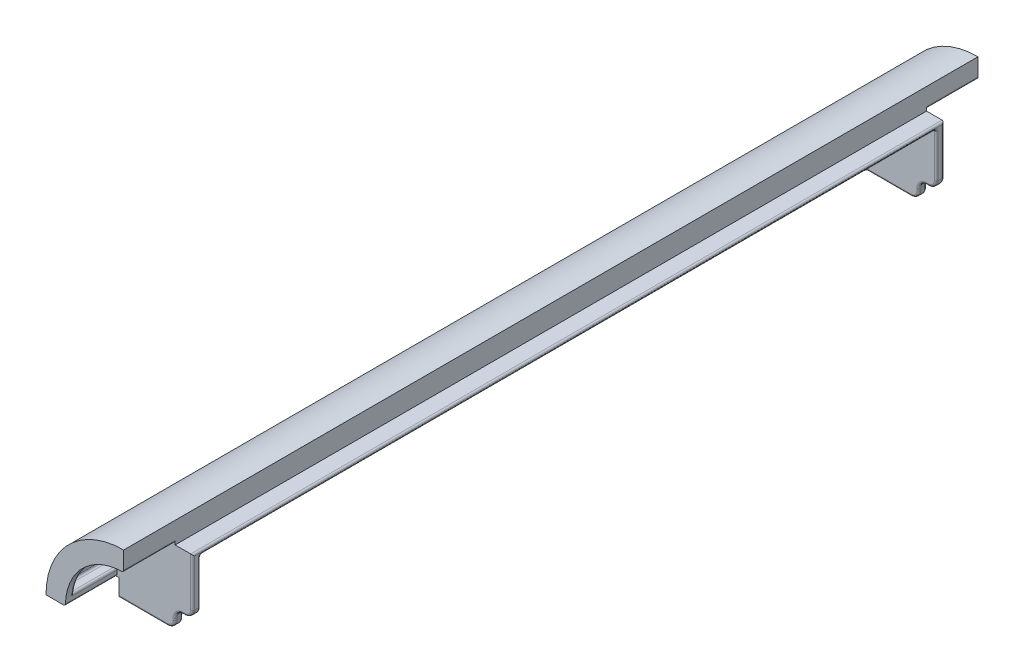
SolidWorks part; units mm, degrees
ref_plane "Plan de face" through (0, 0, 0) normal (0, 0, 1) x (1, 0, 0)
ref_plane "Plan de dessus" through (0, 0, 0) normal (0, 1, 0) x (1, 0, 0)
ref_plane "Plan de droite" through (0, 0, 0) normal (1, 0, 0) x (0, 0, -1)
sketch "Esquisse1" plane through (0, 0, 0) normal (0, 0, 1) x (1, 0, 0)
  line L0 (0, 15) -> (0, 20)
  line L1 (-15, 0) -> (-20, 0)
  arc A0 (0, 20) -> (-20, 0) centre (0, 0) ccw
  arc A1 (0, 15) -> (-15, 0) centre (0, 0) ccw
  dimension "D1" = 20
  dimension "D2" = 5
extrude "Boss.-Extru.1" add sketch "Esquisse1" along normal blind 220
shell "Coque8" thickness 2
sketch "Esquisse2" plane through (0, 0, 0) normal (1, 0, 0) x (0, 0, -1)
  line L0 (-220, 20) -> (0, 20) construction
  line L1 (-206.75, 20) -> (-204.75, 20)
  line L2 (-206.75, 20) -> (-206.75, 0)
  line L3 (-206.75, 0) -> (-204.75, 0)
  line L4 (-204.75, 20) -> (-204.75, 0)
  line L5 (-220, 0) -> (0, 0) construction
  line L6 (-220, 15) -> (-220, 20) construction
  line L7 (-13.25, 20) -> (-15.25, 20)
  line L8 (-13.25, 20) -> (-13.25, 0)
  line L9 (-13.25, 0) -> (-15.25, 0)
  line L10 (-15.25, 20) -> (-15.25, 0)
  line L11 (0, 0) -> (0, 15) construction
  dimension "D1" = 2
  dimension "D2" = 2
  dimension "D3" = 13.25
  dimension "D4" = 13.25
extrude "Boss.-Extru.2" add sketch "Esquisse2" against normal up to surface
sketch "Esquisse3" plane through (0, 0, 13.25) normal (0, 0, -1) x (-1, 0, 0)
  line L0 (0, 0) -> (0, 15) construction
  line L2 (15, 0) -> (0, 0) construction
  circle A0 centre (8, 8) radius 2
  dimension "D1" = 4
  dimension "D2" = 8
  dimension "D3" = 8
extrude "Enlèv. mat.-Extru.1" cut sketch "Esquisse3" against normal up to next
sketch "Esquisse4" plane through (0, 0, 0) normal (0, -1, 0) x (1, 0, 0)
  line L0 (-2, 206.75) -> (-17.8885, 206.75) construction
  line L1 (-14.5, 206.75) -> (0, 206.75)
  line L2 (-14.5, 206.75) -> (-14.5, 204.75)
  line L3 (-14.5, 204.75) -> (0, 204.75)
  line L4 (0, 206.75) -> (0, 204.75)
  line L5 (-14.5, 15.25) -> (0, 15.25)
  line L6 (-14.5, 15.25) -> (-14.5, 13.25)
  line L7 (-14.5, 13.25) -> (0, 13.25)
  line L8 (0, 15.25) -> (0, 13.25)
  line L9 (-2, 15.25) -> (-17.8885, 15.25) construction
  dimension "D1" = 0.5
extrude "Boss.-Extru.3" add sketch "Esquisse4" along normal blind 4.5
sketch "Esquisse5" plane through (0, 0, 0) normal (1, 0, 0) x (0, 0, -1)
  line L0 (-204.75, 15) -> (-15.25, 15) construction
  line L1 (-206.75, 14.5) -> (-204.75, 14.5)
  line L2 (-206.75, 14.5) -> (-206.75, 0)
  line L3 (-206.75, 0) -> (-204.75, 0)
  line L4 (-204.75, 14.5) -> (-204.75, 0)
  line L5 (-15.25, 14.5) -> (-13.25, 14.5)
  line L6 (-15.25, 14.5) -> (-15.25, 0)
  line L7 (-15.25, 0) -> (-13.25, 0)
  line L8 (-13.25, 14.5) -> (-13.25, 0)
  line L9 (-15.25, 17.8885) -> (-15.25, 2) construction
  line L10 (-206.75, 17.8885) -> (-206.75, 2) construction
  dimension "D1" = 0.5
extrude "Boss.-Extru.4" add sketch "Esquisse5" along normal blind 4.5
sketch "Esquisse6" plane through (0, 0, 15.25) normal (0, 0, 1) x (1, 0, 0)
  line L0 (-14.9666, 1) -> (-13.5, 1)
  line L1 (-13.5, 1) -> (-13.5, -4.5)
  line L2 (0, -4.5) -> (-14.5, -4.5) construction
  line L3 (-13.5, -4.5) -> (-14.5, -4.5)
  line L4 (-14.5, -4.5) -> (-14.5, 0)
  line L5 (-14.5, 0) -> (-15, 0)
  line L6 (-1, 14.9666) -> (-1, 13.5)
  line L7 (-1, 13.5) -> (4.5, 13.5)
  line L8 (4.5, 14.5) -> (4.5, 0) construction
  line L9 (4.5, 13.5) -> (4.5, 14.5)
  line L10 (4.5, 14.5) -> (0, 14.5)
  line L11 (4.5, 14.5) -> (0, 14.5) construction
  line L12 (0, 14.5) -> (0, 15)
  arc A0 (-15, 0) -> (-14.9666, 1) centre (0, 0) cw
  arc A1 (0, 15) -> (-1, 14.9666) centre (0, 0) ccw
  dimension "D1" = 1
  dimension "D2" = 1
  dimension "D3" = 1
extrude "Boss.-Extru.5" add sketch "Esquisse6" along normal up to next
fillet "Congé1" radius 2 6 edges at (0, 0, 205.75) (0, 0, 14.25) (0, -4.5, 205.75) (4.5, 0, 205.75) (0, -4.5, 14.25) (4.5, 0, 14.25)
fillet "Congé2" radius 0.5 68 edges at (1.75, 13.5, 15.25) (1.75, 13.5, 204.75) (-13.5, -1.75, 15.25) (-13.5, -1.75, 204.75) (-0.5858, -3.9142, 13.25) (0, -2.25, 13.25) (0.5858, -0.5858, 13.25) (2.25, 0, 13.25) (3.9142, 0.5858, 13.25) (-0.5858, -3.9142, 15.25) (0, -2.25, 15.25) (0.5858, -0.5858, 15.25) (2.25, 0, 15.25) (3.9142, 0.5858, 15.25) (-0.5858, -3.9142, 204.75) (0, -2.25, 204.75) (0.5858, -0.5858, 204.75) (2.25, 0, 204.75) (3.9142, 0.5858, 204.75) (-0.5858, -3.9142, 206.75) (0, -2.25, 206.75) (0.5858, -0.5858, 206.75) (2.25, 0, 206.75) (3.9142, 0.5858, 206.75) (-2, 17.8885, 7.625) (-12.7279, 12.7279, 2) (-17.8885, 2, 7.625) (-12.7279, 12.7279, 13.25) (-8, 10, 13.25) (-8, 6, 15.25) (-17.8885, 2, 212.375) (-12.7279, 12.7279, 218) (-2, 17.8885, 212.375) (-12.7279, 12.7279, 206.75) (-17.8885, 2, 110) (-12.7279, 12.7279, 204.75) (-2, 17.8885, 110) (-12.7279, 12.7279, 15.25) (-1, 14.2333, 15.25) (-1, 14.9666, 110) (-1, 14.2333, 204.75) (-1, 13.5, 110) (-14.2333, 1, 15.25) (-13.5, 1, 110) (-14.2333, 1, 204.75) (-14.9666, 1, 110) (-13.5, -4.5, 110) (-7.75, -4.5, 15.25) (-8.25, -4.5, 13.25) (-14.5, -4.5, 110) (-8.25, -4.5, 206.75) (-7.75, -4.5, 204.75) (4.5, 14.5, 110) (4.5, 8.25, 13.25) (4.5, 7.75, 15.25) (4.5, 13.5, 110) (4.5, 7.75, 204.75) (4.5, 8.25, 206.75) (0, 15, 213.375) (-15, 0, 213.375) (-14.8661, 2, 212.375) (-10.6066, 10.6066, 218) (-2, 14.8661, 212.375) (0, 15, 6.625) (-2, 14.8661, 7.625) (-10.6066, 10.6066, 2) (-14.8661, 2, 7.625) (-15, 0, 6.625)
